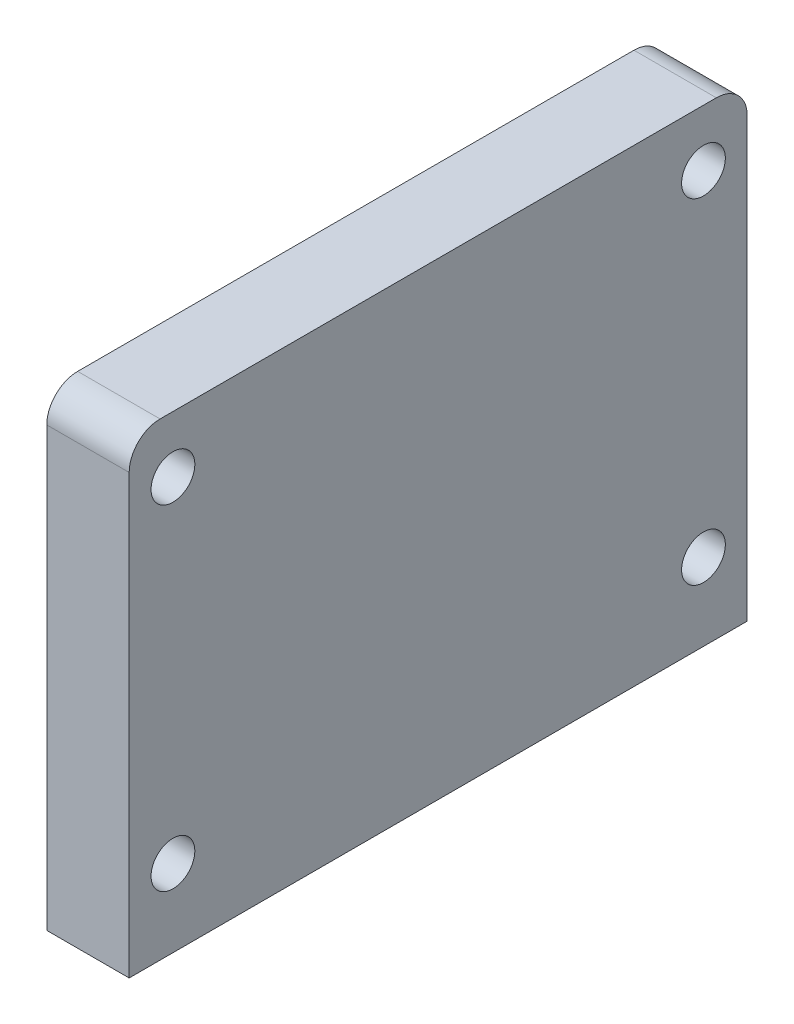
SolidWorks part; units mm, degrees
ref_plane "Ebene vorne" through (0, 0, 0) normal (0, 0, 1) x (1, 0, 0)
ref_plane "Ebene oben" through (0, 0, 0) normal (0, 1, 0) x (1, 0, 0)
ref_plane "Ebene rechts" through (0, 0, 0) normal (1, 0, 0) x (0, 0, -1)
sketch "Skizze9" plane through (0, 0, 0) normal (-1, 0, 0) x (0, 0, 1)
  line L1 (60, -48) -> (-60, -48)
  line L8 (60, 37) -> (60, -48)
  line L9 (-60, 37) -> (-60, -48)
  line L10 (60, -45.5) -> (-62.5, -45.5) construction
  line L11 (54, 43) -> (-54, 43)
  line L12 (62.5, -45.5) -> (-60, -45.5) construction
  line L13 (-60, 46) -> (-60, -45.5) construction
  line L15 (60, 46) -> (60, -45.5) construction
  line L16 (62.5, -48) -> (-62.5, -48) construction
  line L18 (-62.5, 46) -> (-62.5, -48) construction
  line L19 (62.5, 46) -> (62.5, -48) construction
  arc A0 (-54, 43) -> (-60, 37) centre (-54, 37) ccw
  arc A1 (60, 37) -> (54, 43) centre (54, 37) ccw
  dimension "D4" = 43
  dimension "D1" = 6
  dimension "D2" = 120
  dimension "D3" = 60
  dimension "D5" = 91
extrude "Linear austragen1" add sketch "Skizze9" along normal blind 16
hole_wizard "M10 Gewindebohrung1" positions "Skizze13" profile "Skizze12" tap size "M10" standard "DIN"
sketch "Skizze13" plane through (0, 0, 0) normal (1, 0, 0) x (0, 0, -1)
  line L0 (0, 43) -> (0, -48) construction
  line L1 (-54, 43) -> (54, 43) construction
  line L2 (60, -48) -> (-60, -48) construction
  point P0 (-51.5, 32)
  point P3 (-51.5, -33)
  point P14 (51.5, 32)
  point P15 (51.5, -33)
  dimension "D1" = 103
  dimension "D2" = 80
  dimension "D3" = 15
sketch "Skizze12" plane through (0, 32, 51.5) normal (0, 1, 0) x (0, 0, -1)
  line L0 (0, 0) -> (0, 30.0537)
  line L1 (0, 30.0537) -> (4.25, 27.5)
  line L2 (4.25, 27.5) -> (4.25, 0)
  line L5 (4.25, 0) -> (0, 0)
  line L10 (0, 30.0537) -> (-4.25, 27.5) construction
  line L11 (0, -6.35) -> (0, 107.95) construction
  dimension "Bohrerdurchmesser" = 8.5
  dimension "Bohrungstiefe" = 27.5
  dimension "Spitzenwinkel" = 118
